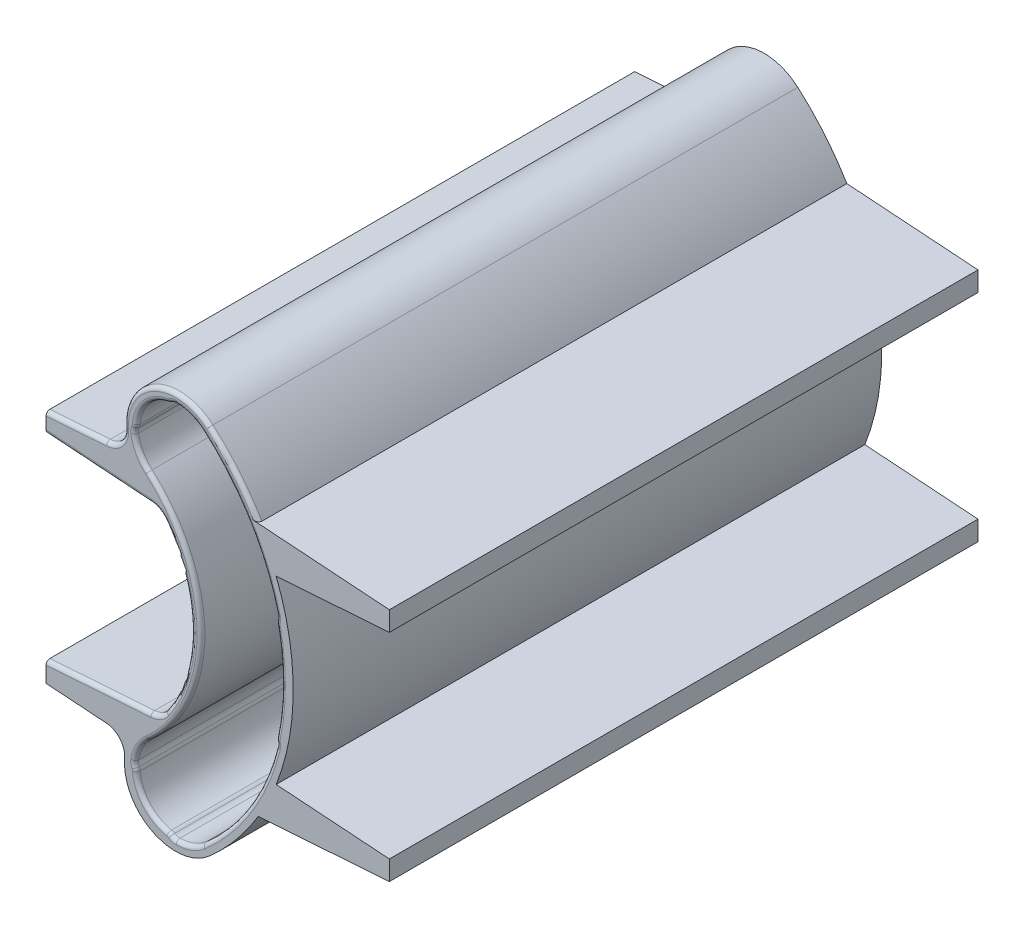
SolidWorks part; units mm, degrees
ref_plane "Front Plane" through (0, 0, 0) normal (0, 0, 1) x (1, 0, 0)
ref_plane "Top Plane" through (0, 0, 0) normal (0, 1, 0) x (1, 0, 0)
ref_plane "Right Plane" through (0, 0, 0) normal (1, 0, 0) x (0, 0, -1)
sketch "Sketch1" plane through (0, 0, 0) normal (0, 0, 1) x (1, 0, 0)
  line L0 (0, 0) -> (126.5517, 0) construction
  line L1 (0, 0) -> (65.9983, -75.128) construction
  line L2 (0, 0) -> (65.9983, 75.128) construction
  arc A9 (48.8388, -55.5947) -> (83.1579, -94.6613) centre (65.9983, -75.128) ccw
  arc A10 (83.1579, -94.6613) -> (83.1579, 94.6613) centre (0, 0) ccw
  arc A11 (83.1579, 94.6613) -> (48.8388, 55.5947) centre (65.9983, 75.128) ccw
  arc A12 (48.8388, -55.5947) -> (48.8388, 55.5947) centre (0, 0) ccw
  arc A13 (52.1387, -59.3512) -> (79.858, -90.9049) centre (65.9983, -75.128) ccw
  arc A14 (52.1387, -59.3512) -> (52.1387, 59.3512) centre (0, 0) ccw
  arc A15 (79.858, 90.9049) -> (52.1387, 59.3512) centre (65.9983, 75.128) ccw
  arc A16 (79.858, -90.9049) -> (79.858, 90.9049) centre (0, 0) ccw
  dimension "D1" = 79
  dimension "D2" = 42
  dimension "D3" = 5
  dimension "D4" = 48.701
extrude "Extrude1" add sketch "Sketch1" along normal blind 300
sketch "Sketch3" plane through (0, 0, 0) normal (1, 0, 0) x (0, 0, -1)
  line L0 (17.1923, 0) -> (-312.4893, 0) construction
  line L1 (0, -55.5947) -> (0, 55.5947) construction
  line L4 (-300, -50) -> (0, -50)
  line L5 (-300, -50) -> (-300, -60)
  line L6 (-300, -60) -> (0, -60)
  line L7 (0, -50) -> (0, -60)
  line L8 (-300, 55.5947) -> (-300, -55.5947) construction
  dimension "D1" = 10
  dimension "D2" = 100
extrude "Extrude2" add sketch "Sketch3" along normal up to body
draft "Draft1" type of draft neutral plane draft angle 4 faces to draft 2 parameters "D1"=4
ref_plane "Plane3" through (175, 0, 0) normal (1, 0, 0) x (0, 0, -1)
sketch "Sketch10" plane through (175, 0, 0) normal (1, 0, 0) x (0, 0, -1)
  line L4 (-300, -50) -> (-300, -60)
  line L5 (0, -50) -> (-300, -50)
  line L6 (0, -60) -> (0, -50)
  line L7 (-300, -60) -> (0, -60)
  line L8 (-300, -50) -> (-300, -60)
  line L9 (0, -50) -> (-300, -50)
  line L10 (0, -60) -> (0, -50)
  line L11 (-300, -60) -> (0, -60)
  dimension "D1" = 0
extrude "Extrude6" add sketch "Sketch10" against normal up to body
draft "Draft2" type of draft neutral plane draft angle 4 faces to draft 2 parameters "D1"=4
mirror "Mirror1" about plane through (0, 0, 0) normal (0, 1, 0) of "Draft2", "Extrude6", "Draft1", "Extrude2"
fillet "Fillet1" radius 10 4 edges at (42.9968, -63.0066, 150) (42.9968, 63.0066, 150) (58.0103, -45.9435, 150) (58.0103, 45.9435, 150)
ref_plane "Plane1" through (0, 0, 50) normal (0, 0, 1) x (1, 0, 0)
sketch "Sketch4" plane through (0, 0, 50) normal (0, 0, 1) x (1, 0, 0)
  line L0 (0, -33.0385) -> (0, 33.0385) construction
  circle A1 centre (65, 0) radius 3.75
  arc A2 (62.9654, 9.7908) -> (62.9654, -9.7908) centre (65, 0) ccw
  arc A3 (60.9541, -41.9594) -> (60.9541, 41.9594) centre (0, 0) ccw construction
  arc A4 (70.4512, -22.6413) -> (70.4512, 22.6413) centre (0, 0) ccw
  arc A5 (70.4512, -22.6413) -> (62.9654, -9.7908) centre (60.9308, -19.5817) ccw
  arc A6 (70.4512, 22.6413) -> (62.9654, 9.7908) centre (60.9308, 19.5817) cw
  point P13 (74, 0)
  dimension "D2" = 7.5
  dimension "D3" = 20
  dimension "D4" = 10
  dimension "D1" = 65
extrude "Extrude3" add sketch "Sketch4" along normal blind 25
sketch "Sketch5" plane through (0, 0, 0) normal (1, 0, 0) x (0, 0, -1)
  line L0 (0, 0) -> (-27.1601, 0) construction
  line L1 (-45, 40) -> (-40, 40)
  line L2 (-45, 40) -> (-45, -40)
  line L3 (-45, -40) -> (-40, -40)
  line L4 (-40, 40) -> (-40, -40)
  line L5 (0, -41.9594) -> (0, 41.9594) construction
  line L6 (-42.5, -40) -> (-42.5, 40) construction
  line L7 (-50, -9.7908) -> (-50, 9.7908) construction
  dimension "D1" = 5
  dimension "D2" = 5
  dimension "D3" = 80
extrude "Cut-Extrude2" cut sketch "Sketch5" along normal up to next contours L2 L3 L4 L1
pattern_linear "LPattern1" count 2 spacing 17.5 along (0, 0, -1) of "Cut-Extrude2"
sketch "Sketch7" plane through (0, 0, 300) normal (0, 0, 1) x (1, 0, 0)
  line L0 (65.9983, -75.128) -> (48.7189, -90.3077) construction
  line L1 (65.9983, 75.128) -> (48.7189, 90.3077) construction
  line L2 (46.0035, 75.5813) -> (43.0042, 75.6493)
  line L3 (62.5188, 97.8633) -> (62.9726, 94.8978)
  line L4 (62.5188, -97.8633) -> (62.9726, -94.8978)
  line L5 (46.0035, -75.5813) -> (43.0042, -75.6493)
  line L10 (0, 0) -> (123, 0) construction
  line L12 (117.1555, -25.9728) -> (120.0844, -26.6221)
  line L13 (120.0844, 26.6221) -> (117.1555, 25.9728)
  arc A0 (43.0042, 75.6493) -> (62.5188, 97.8633) centre (65.9983, 75.128) cw
  arc A1 (46.0035, 75.5813) -> (62.9726, 94.8978) centre (65.9983, 75.128) cw
  arc A2 (46.0035, -75.5813) -> (62.9726, -94.8978) centre (65.9983, -75.128) ccw
  arc A6 (43.0042, -75.6493) -> (62.5188, -97.8633) centre (65.9983, -75.128) ccw
  arc A11 (79.858, -90.9049) -> (79.858, 90.9049) centre (0, 0) ccw construction
  arc A12 (120.0844, -26.6221) -> (120.0844, 26.6221) centre (0, 0) ccw
  arc A13 (117.1555, -25.9728) -> (117.1555, 25.9728) centre (0, 0) ccw
  arc A15 (52.1387, -59.3512) -> (79.858, -90.9049) centre (65.9983, -75.128) ccw construction
  dimension "D1" = 3
  dimension "D2" = 1
  dimension "D3" = 1
  dimension "D4" = 2
  dimension "D5" = 80
  dimension "D6" = 25
extrude "Extrude4" add sketch "Sketch7" against normal up to surface (300 mm away)
fillet "Fillet2" radius 5 6 edges at (118.1318, 26.1892, 150) (118.1318, -26.1892, 150) (62.8213, -95.8863, 150) (45.0037, -75.604, 150) (45.0037, 75.604, 150) (62.8213, 95.8863, 150)
fillet "Fillet3" radius 5 6 edges at (62.9726, 94.8978, 150) (46.0035, 75.5813, 150) (46.0035, -75.5813, 150) (62.9726, -94.8978, 150) (117.1555, 25.9728, 150) (117.1555, -25.9728, 150)
fillet "Fillet4" radius 2 62 edges at (26.7073, 48.1324, 0) (26.7073, 48.1324, 300) (57.676, 44.9731, 0) (57.676, 44.9731, 300) (74, 0, 0) (74, 0, 300) (57.676, -44.9731, 0) (57.676, -44.9731, 300) (15.4104, -61.0776, 0) (37.7146, -65.6215, 0) (96.8141, -80.6414, 0) (96.8141, 80.6414, 300) (73.5612, -94.7189, 0) (73.5612, -94.7189, 300) (64.9205, -95.9446, 0) (64.9205, -95.9446, 300) (62.8257, -94.9734, 0) (62.8257, -94.9734, 300) (50.9727, -88.3277, 0) (45.9096, -75.7173, 0) (45.9096, -75.7173, 300) (45.2163, -73.5148, 300) (45.2163, -73.5148, 0) (47.5452, -65.104, 300) (47.5452, -65.104, 0) (79, 0, 0) (79, 0, 300) (47.5452, 65.104, 0) (47.5452, 65.104, 300) (45.2163, 73.5148, 0) (45.2163, 73.5148, 300) (45.9096, 75.7173, 0) (45.9096, 75.7173, 300) (50.9727, 88.3277, 0) (62.8257, 94.9734, 0) (62.8257, 94.9734, 300) (64.9205, 95.9446, 300) (64.9205, 95.9446, 0) (73.5612, 94.7189, 300) (73.5612, 94.7189, 0) (103.3575, 62.9144, 0) (103.3575, 62.9144, 300) (117.5752, 28.0226, 0) (117.5752, 28.0226, 300) (117.3216, 25.7849, 0) (117.3216, 25.7849, 300) (120, 0, 0) (117.3216, -25.7849, 0) (117.3216, -25.7849, 300) (117.5752, -28.0226, 300) (117.5752, -28.0226, 0) (26.7073, -48.1324, 300) (15.4104, 61.0776, 300) (37.7146, 65.6215, 300) (120, 0, 300) (103.3575, -62.9144, 300) (103.3575, -62.9144, 0) (50.9727, -88.3277, 300) (50.9727, 88.3277, 300) (26.7073, -48.1324, 0) (54.3004, -98.3478, 0) (54.3004, 98.3478, 300)
fillet "Fillet5" radius 2.5 6 edges at (69.5716, 14.5481, 50) (55, 0, 50) (69.5716, 14.5481, 75) (55, 0, 75) (69.5716, -14.5481, 50) (69.5716, -14.5481, 75)
fillet "Fillet6" radius 2 6 edges at (71.7237, -18.2131, 50.5965) (71.7237, 18.2131, 50.5965) (71.7237, -18.2131, 74.4035) (71.7237, 18.2131, 74.4035) (74, 0, 50) (74, 0, 75)
ref_plane "Plane2" through (0, 0, 104) normal (0, 0, -1) x (-1, 0, 0)
sketch "Sketch8" plane through (0, 0, 104) normal (0, 0, -1) x (-1, 0, 0)
  line L3 (0, 0) -> (-54.25, 0) construction
  line L4 (-60.6048, 24.1788) -> (-60.6048, -24.1788) construction
  line L6 (-36.4496, 26.4026) -> (-66.1706, 33.1279)
  line L7 (-66.1706, -33.1279) -> (-36.4496, -26.4026)
  line L8 (-30.6048, -19.0875) -> (-30.6048, 19.0875)
  arc A6 (-66.1706, 33.1279) -> (-66.1706, -33.1279) centre (0, 0) ccw
  circle A7 centre (-54.25, 0) radius 25 construction
  circle A12 centre (-60.6048, -24.1788) radius 2.5
  arc A13 (-36.4496, -26.4026) -> (-30.6048, -19.0875) centre (-38.1048, -19.0875) ccw
  arc A14 (-30.6048, 19.0875) -> (-36.4496, 26.4026) centre (-38.1048, 19.0875) ccw
  circle A15 centre (-38.1048, -19.0875) radius 2.5
  circle A16 centre (-38.1048, 19.0875) radius 2.5
  circle A17 centre (-60.6048, 24.1788) radius 2.5
  dimension "D1" = 30.6048
  dimension "D3" = 7.5
  dimension "D5" = 50
  dimension "D6" = 5
  dimension "D2" = 25.5
  dimension "D4" = 38.1751
  dimension "D7" = 48.3577
extrude "Extrude5" add sketch "Sketch8" along normal blind 5
fillet "Fillet7" radius 5 2 edges at (66.1706, 33.1279, 101.5) (66.1706, -33.1279, 101.5)
sketch "Sketch9" plane through (0, 0, 99) normal (0, 0, -1) x (-1, 0, 0)
  circle A1 centre (-54.25, 0) radius 17.5
  dimension "D1" = 35
extrude "Cut-Extrude3" cut sketch "Sketch9" against normal up to next
sketch "Sketch11" plane through (0, 0, 75) normal (0, 0, 1) x (1, 0, 0)
  circle A0 centre (65, 0) radius 3.75 construction
  circle A1 centre (65, 0) radius 3.75
  circle A2 centre (65, 0) radius 6
  dimension "D1" = 12
extrude "Extrude7" add sketch "Sketch11" along normal blind 4
